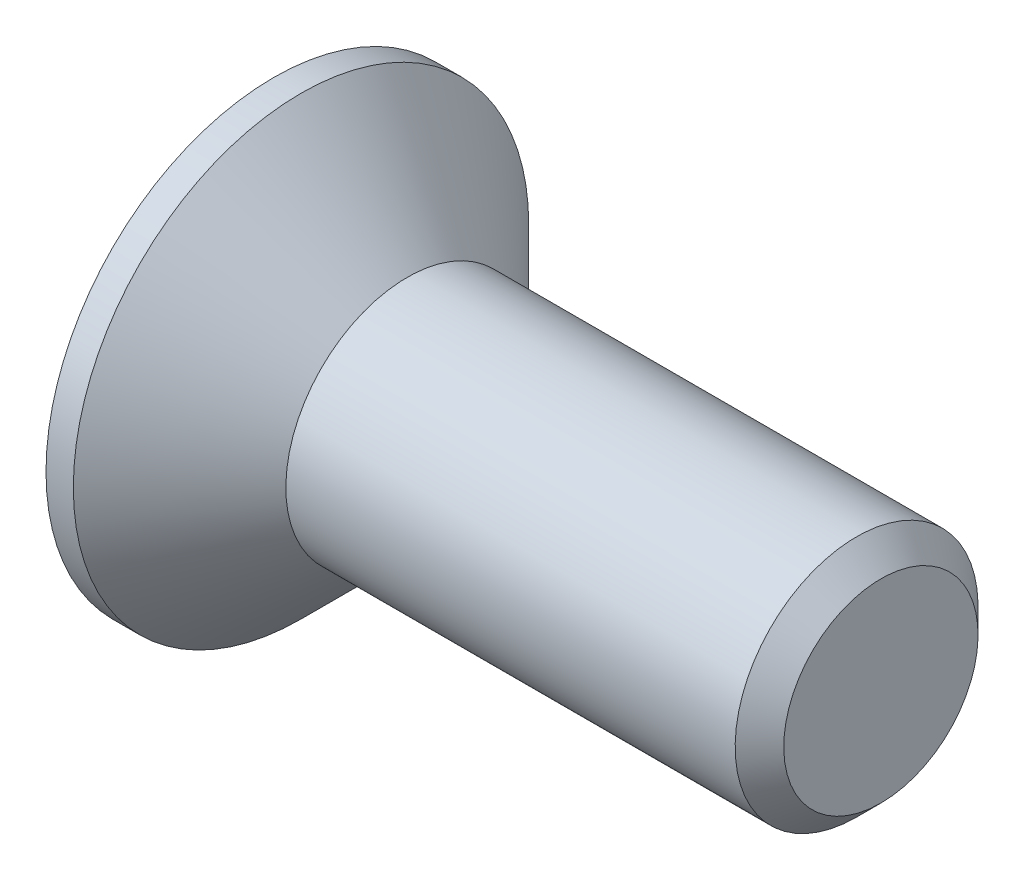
SolidWorks part; units mm, degrees
ref_plane "Front Plane" through (0, 0, 0) normal (0, 0, 1) x (1, 0, 0)
ref_plane "Top Plane" through (0, 0, 0) normal (0, 1, 0) x (1, 0, 0)
ref_plane "Right Plane" through (0, 0, 0) normal (1, 0, 0) x (0, 0, -1)
sketch "Sketch1" plane through (0, 0, 0) normal (0, 0, 1) x (1, 0, 0)
  line L1 (-2.2, 3.75) -> (-2.2, 0)
  line L2 (-2.2, 0) -> (7.8, 0)
  line L3 (7.8, 0) -> (7.8, 2)
  line L4 (7.8, 2) -> (0, 2)
  line L5 (-2.2, 3.75) -> (-1.75, 3.75)
  line L6 (-1.75, 3.75) -> (0, 2)
  dimension "D1" = 2
  dimension "D2" = 45
  dimension "D3" = 2.2
  dimension "D4" = 10
  dimension "D5" = 3.75
revolve "Revolve1" add sketch "Sketch1" angle 360 about L2
chamfer "Chamfer1" distance 0.4 angle 45 1 edges at (7.8, -2, 0)
sketch "Sketch2" plane through (-2.2, 0, 0) normal (-1, 0, 0) x (0, 0, 1)
  line L0 (-0.55, 2.2) -> (0.55, 2.2)
  line L1 (0.55, 2.2) -> (0.55, 0.55)
  line L2 (0.55, 0.55) -> (2.2, 0.55)
  line L3 (2.2, 0.55) -> (2.2, -0.55)
  line L4 (2.2, -0.55) -> (0.55, -0.55)
  line L5 (0.55, -0.55) -> (0.55, -2.2)
  line L6 (0.55, -2.2) -> (-0.55, -2.2)
  line L7 (-0.55, -2.2) -> (-0.55, -0.55)
  line L8 (-0.55, -0.55) -> (-2.2, -0.55)
  line L9 (-2.2, -0.55) -> (-2.2, 0.55)
  line L10 (-2.2, 0.55) -> (-0.55, 0.55)
  line L11 (-0.55, 0.55) -> (-0.55, 2.2)
  point P2 (0, 2.2)
  point P14 (0, -2.2)
  point P15 (2.2, 0)
  point P16 (-2.2, 0)
  dimension "D1" = 4.4
  dimension "D2" = 1.1
extrude "Cut-Extrude1" cut sketch "Sketch2" against normal blind 1.9
